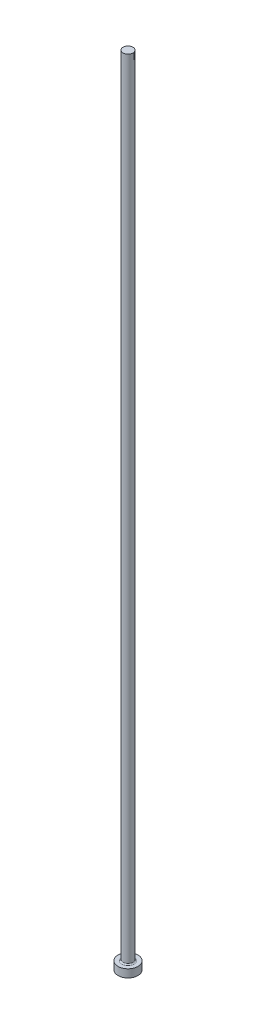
SolidWorks part; units mm, degrees
ref_plane "Plano frontal" through (0, 0, 0) normal (0, 0, 1) x (1, 0, 0)
ref_plane "Plano superior" through (0, 0, 0) normal (0, 1, 0) x (1, 0, 0)
ref_plane "Plano direito" through (0, 0, 0) normal (1, 0, 0) x (0, 0, -1)
sketch "Esboço1" plane through (0, 0, 0) normal (0, 0, 1) x (1, 0, 0)
  line L0 (0, 0) -> (2.5, 0)
  line L1 (2.5, 0) -> (2.5, 2)
  line L2 (2.5, 2) -> (1.55, 2)
  line L3 (1.25, 2.3) -> (1.25, 200)
  line L4 (1.25, 200) -> (0, 200)
  line L5 (0, 200) -> (0, 0) construction
  line L6 (0, 0) -> (0, 200)
  arc A0 (1.55, 2) -> (1.25, 2.3) centre (1.55, 2.3) cw
  dimension "D3" = 0.3
  dimension "D1" = 5
  dimension "D2" = 2.5
  dimension "D4" = 2
  dimension "D5" = 200
revolve "Revolução1" add sketch "Esboço1" angle 360 about L5
sketch "Esboço2"
  dimension "D1" = 0.2812
  dimension "D2" = 0.4375
  dimension "D3" = 0.1875
  dimension "D4" = 1.3438
wrap "Envolver1" sketch "Esboço2" wrap type deboss source sketch "Esboço2" thickness 0.1 parameters "D1"=0.1
